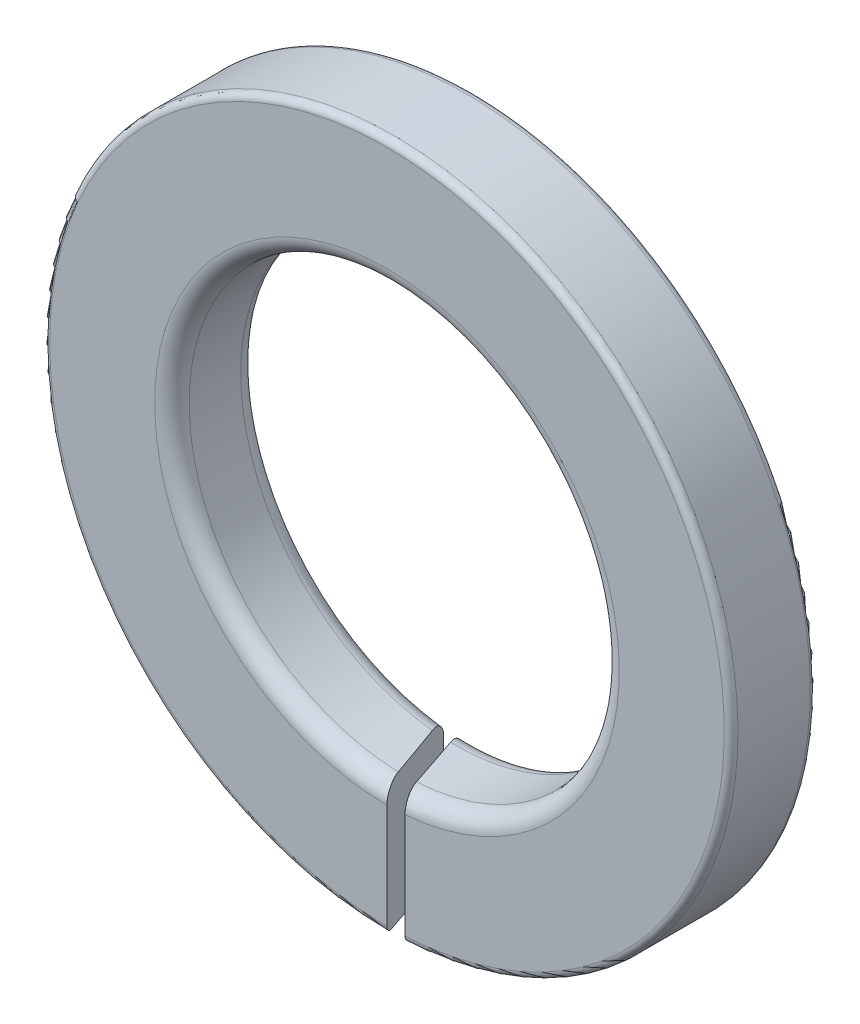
SolidWorks part; units mm, degrees
ref_plane "Plan de face" through (0, 0, 0) normal (0, 0, 1) x (1, 0, 0)
ref_plane "Plan de dessus" through (0, 0, 0) normal (0, 1, 0) x (1, 0, 0)
ref_plane "Plan de droite" through (0, 0, 0) normal (1, 0, 0) x (0, 0, -1)
sketch "Esquisse1" plane through (0, 0, 0) normal (0, 0, 1) x (1, 0, 0)
  circle A0 centre (0, 0) radius 6.25
  circle A1 centre (0, 0) radius 10
  dimension "D1" = 20
  dimension "D2" = 12.5
extrude "Extrusion1" add sketch "Esquisse1" along normal blind 2.5
sketch "Esquisse2" plane through (0, 0, 0) normal (0, 1, 0) x (1, 0, 0)
  line L0 (-0.8517, 0) -> (0, -2.5)
  line L1 (10, 0) -> (-10, 0) construction
  line L2 (-10, -2.5) -> (10, -2.5) construction
  line L3 (0.5246, -2.5) -> (-0.327, 0)
  line L4 (-0.8517, 0) -> (-0.327, 0)
  line L5 (0, -2.5) -> (0.5246, -2.5)
  dimension "D1" = 0.4966
extrude "Enlèv. mat.-Extru.1" cut sketch "Esquisse2" against normal through all
fillet "Congé1" radius 0.5 2 edges at (-0.2625, 6.2445, 2.5) (0.5899, 6.2221, 0)
fillet "Congé2" radius 0.2 2 edges at (-0.2624, 9.9966, 2.5) (0.5896, 9.9826, 0)
